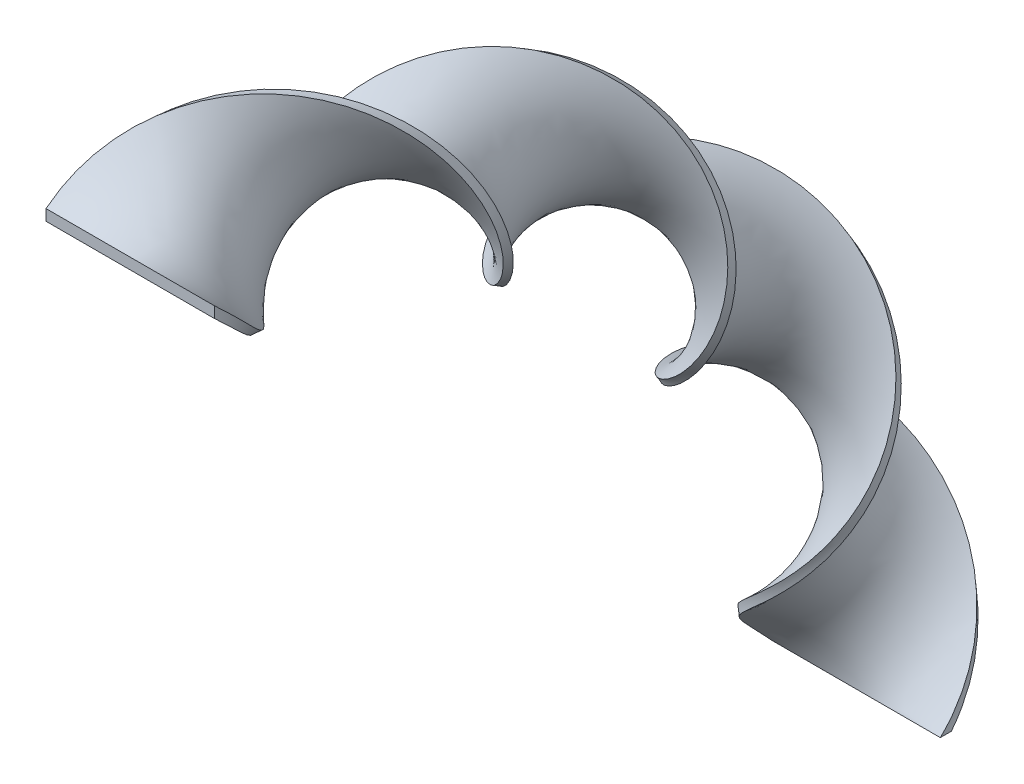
SolidWorks part; units mm, degrees
ref_plane "Front Plane" through (0, 0, 0) normal (0, 0, 1) x (1, 0, 0)
ref_plane "Top Plane" through (0, 0, 0) normal (0, 1, 0) x (1, 0, 0)
ref_plane "Right Plane" through (0, 0, 0) normal (1, 0, 0) x (0, 0, -1)
sketch "Sketch1" plane through (0, 0, 0) normal (0, 0, 1) x (1, 0, 0)
  line L0 (52.1269, 3.4119) -> (-52.1269, -3.4119) construction
  line L1 (-52.1269, 3.4119) -> (52.1269, 3.4119)
  line L2 (-52.1269, 3.4119) -> (-52.1269, -3.4119)
  line L3 (-52.1269, -3.4119) -> (52.1269, -3.4119)
  line L4 (52.1269, 3.4119) -> (52.1269, -3.4119)
sketch "Sketch2" plane through (0, 0, 0) normal (1, 0, 0) x (0, 0, -1)
  arc A0 (0, 0) -> (451.7713, -451.7713) centre (0, -451.7713) cw
sweep "Sweep1" add profiles "Sketch1" path "Sketch2" parameters "D1"=720
